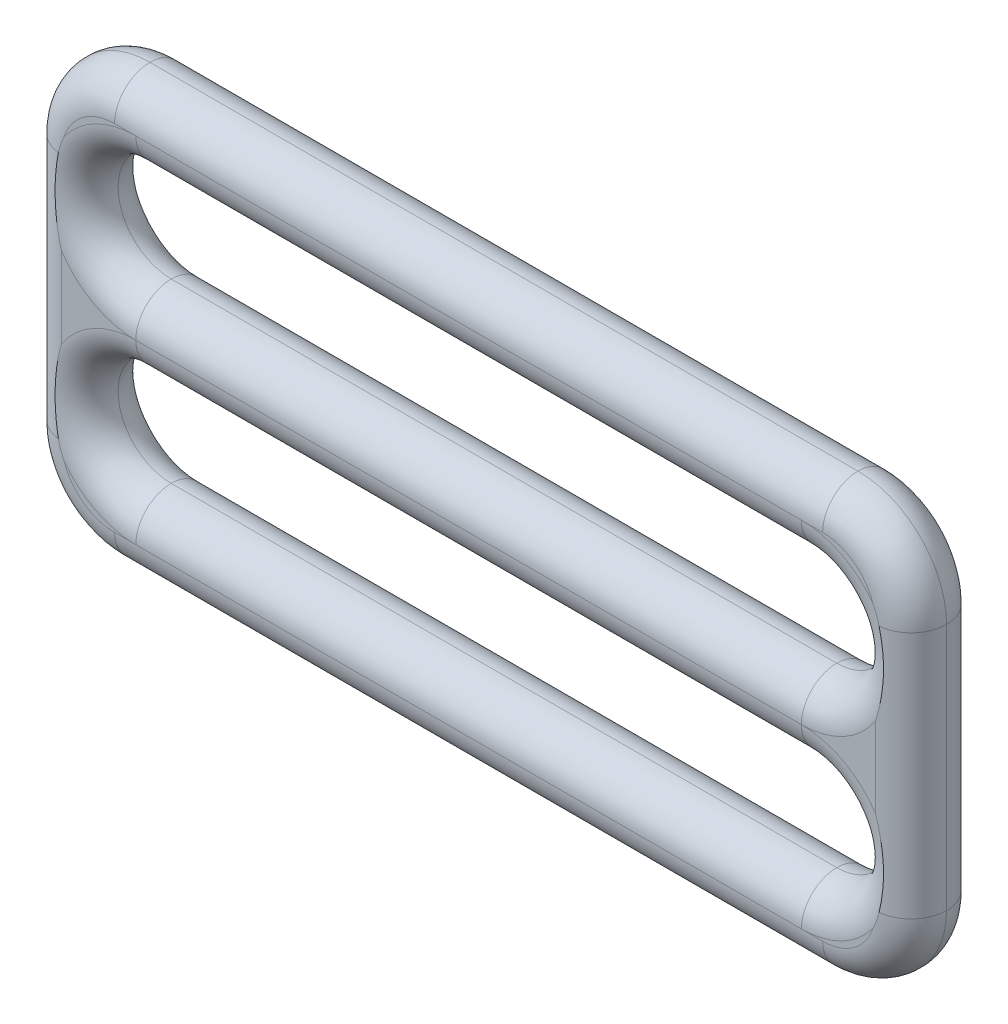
SolidWorks part; units mm, degrees
ref_plane "Front Plane" through (0, 0, 0) normal (0, 0, 1) x (1, 0, 0)
ref_plane "Top Plane" through (0, 0, 0) normal (0, 1, 0) x (1, 0, 0)
ref_plane "Right Plane" through (0, 0, 0) normal (1, 0, 0) x (0, 0, -1)
sketch "Sketch1" plane through (0, 0, 0) normal (0, 0, 1) x (1, 0, 0)
  line L0 (0, -7.62) -> (0, 7.62) construction
  line L1 (-12.7, -7.62) -> (12.7, -7.62)
  line L2 (-15.875, -4.445) -> (-15.875, 4.445)
  line L3 (-12.7, 7.62) -> (12.7, 7.62)
  line L4 (15.875, -4.445) -> (15.875, 4.445)
  line L5 (-15.875, -7.62) -> (15.875, 7.62) construction
  line L6 (-15.875, 7.62) -> (15.875, -7.62) construction
  line L7 (-11.938, 3.175) -> (11.938, 3.175) construction
  line L8 (-11.938, 5.08) -> (11.938, 5.08)
  line L9 (-11.938, 1.27) -> (11.938, 1.27)
  line L10 (-15.875, 0) -> (15.875, 0) construction
  line L11 (-11.938, -3.175) -> (11.938, -3.175) construction
  line L12 (-11.938, -5.08) -> (11.938, -5.08)
  line L13 (-11.938, -1.27) -> (11.938, -1.27)
  arc A0 (12.7, 7.62) -> (15.875, 4.445) centre (12.7, 4.445) cw
  arc A1 (12.7, -7.62) -> (15.875, -4.445) centre (12.7, -4.445) ccw
  arc A2 (-12.7, -7.62) -> (-15.875, -4.445) centre (-12.7, -4.445) cw
  arc A3 (-15.875, 4.445) -> (-12.7, 7.62) centre (-12.7, 4.445) cw
  arc A4 (-11.938, 5.08) -> (-11.938, 1.27) centre (-11.938, 3.175) ccw
  arc A5 (11.938, 1.27) -> (11.938, 5.08) centre (11.938, 3.175) ccw
  arc A6 (-11.938, -5.08) -> (-11.938, -1.27) centre (-11.938, -3.175) cw
  arc A7 (11.938, -1.27) -> (11.938, -5.08) centre (11.938, -3.175) cw
  point P0 (0, 0)
  point P22 (0, 3.175)
  point P32 (0, -3.175)
  dimension "D1" = 3.175
  dimension "D2" = 3.81
  dimension "D3" = 23.876
  dimension "D5" = 15.24
  dimension "D6" = 2.54
extrude "Boss-Extrude1" add sketch "Sketch1" along normal mid plane 2.54
fillet "Fillet1" radius 1.27 32 edges at (14.9451, 6.6901, 1.27) (15.875, 0, 1.27) (14.9451, -6.6901, 1.27) (0, -7.62, 1.27) (-14.9451, -6.6901, 1.27) (-15.875, 0, 1.27) (-14.9451, 6.6901, 1.27) (14.9451, 6.6901, -1.27) (15.875, 0, -1.27) (14.9451, -6.6901, -1.27) (0, -7.62, -1.27) (-14.9451, -6.6901, -1.27) (-15.875, 0, -1.27) (-14.9451, 6.6901, -1.27) (0, -1.27, 1.27) (13.843, -3.175, 1.27) (0, -5.08, 1.27) (0, -1.27, -1.27) (13.843, -3.175, -1.27) (0, -5.08, -1.27) (0, 5.08, 1.27) (13.843, 3.175, 1.27) (0, 1.27, 1.27) (-13.843, 3.175, -1.27) (0, 5.08, -1.27) (13.843, 3.175, -1.27) (0, 7.62, 1.27) (0, 7.62, -1.27) (-13.843, -3.175, 1.27) (-13.843, -3.175, -1.27) (-13.843, 3.175, 1.27) (0, 1.27, -1.27)
